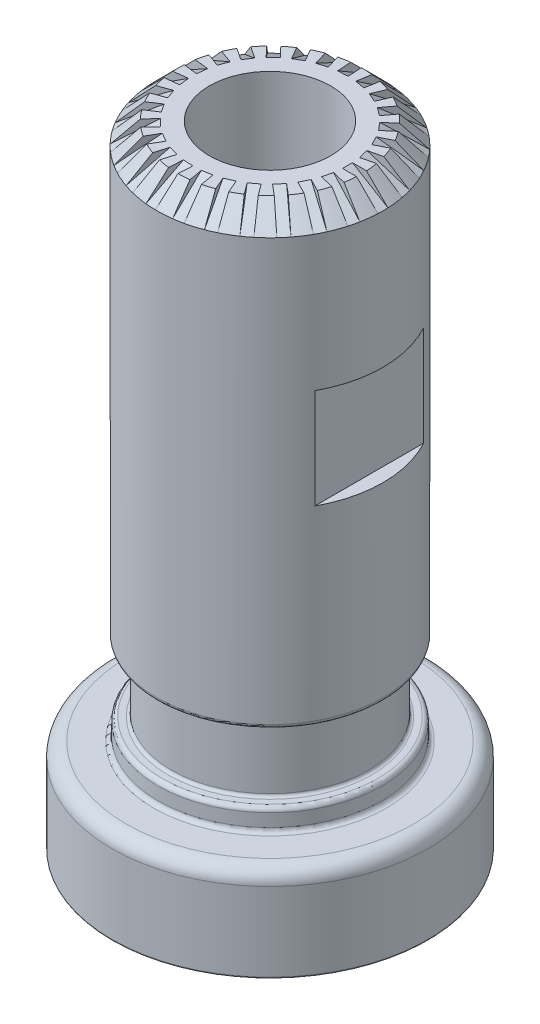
SolidWorks part; units mm, degrees
ref_plane "Plan de face" through (0, 0, 0) normal (0, 0, 1) x (1, 0, 0)
ref_plane "Plan de dessus" through (0, 0, 0) normal (0, 1, 0) x (1, 0, 0)
ref_plane "Plan de droite" through (0, 0, 0) normal (1, 0, 0) x (0, 0, -1)
sketch "Esquisse1" plane through (0, 0, 0) normal (0, 0, 1) x (1, 0, 0)
  line L0 (0, 0) -> (0, 50.3974) construction
  line L1 (2.75, 21.15) -> (2.75, 5.2)
  line L2 (4.2, 5.2) -> (4.2, 3)
  line L3 (8.1, 3) -> (8.1, 0.5)
  line L4 (8.1, 0.5) -> (9, 0.5)
  line L5 (9, 0.5) -> (9.3, 0)
  line L6 (9.3, 0) -> (9.7, 0)
  line L7 (9.7, 0) -> (10, 0.5)
  line L8 (10, 0.5) -> (11.075, 0.5)
  line L9 (11.075, 0.5) -> (11.075, 7.1)
  line L10 (4.2, 3) -> (8.1, 3)
  line L11 (2.75, 5.2) -> (4.2, 5.2)
  line L12 (11.075, 7.1) -> (7.85, 7.1)
  line L13 (7.85, 7.1) -> (7.85, 8.6)
  line L14 (6.925, 8.6) -> (6.925, 13.4)
  line L15 (7.85, 8.6) -> (6.925, 8.6)
  line L16 (6.925, 13.4) -> (7.925, 13.4)
  line L17 (7.925, 13.4) -> (7.925, 43.25)
  line L18 (2.75, 21.15) -> (1.25, 21.15)
  line L19 (1.25, 21.15) -> (1.25, 23.25)
  line L20 (6.425, 44.75) -> (4.25, 44.75)
  line L21 (7.925, 43.25) -> (6.425, 44.75)
  line L22 (2.75, 36.3) -> (4.25, 36.3)
  line L23 (4.25, 36.3) -> (4.25, 44.75)
  line L24 (2.75, 36.3) -> (2.75, 23.25)
  line L25 (2.75, 23.25) -> (1.25, 23.25)
  point P21 (7.925, 44.75)
  dimension "D1" = 5.5
  dimension "D2" = 8.4
  dimension "D3" = 16.2
  dimension "D4" = 22.15
  dimension "D5" = 20
  dimension "D6" = 1
  dimension "D7" = 0.3
  dimension "D8" = 0.4
  dimension "D9" = 3
  dimension "D10" = 5.2
  dimension "D11" = 0.5
  dimension "D12" = 0.5
  dimension "D13" = 7.1
  dimension "D14" = 15.7
  dimension "D15" = 8.6
  dimension "D16" = 13.85
  dimension "D17" = 4.8
  dimension "D18" = 44.75
  dimension "D19" = 15.85
  dimension "D20" = 21.15
  dimension "D21" = 2.5
  dimension "D24" = 1.5
  dimension "D22" = 8.5
  dimension "D23" = 8.45
  dimension "D25" = 5.5
  dimension "D26" = 21.5
revolve "Révolution1" add sketch "Esquisse1" angle 360 about L0
fillet "Congé1" radius 1 1 edges at (0, 7.1, -11.075)
fillet "Congé2" radius 0.2 2 edges at (0, 8.6, -6.925) (0, 13.4, -6.925)
fillet "Congé3" radius 0.3 3 edges at (0, 7.1, -7.85) (0, 8.6, -7.85) (0, 13.4, -7.925)
fillet "Congé4" radius 0.1 8 edges at (0, 3, -4.2) (0, 3, -8.1) (0, 0, -9.3) (0, 0, -9.7) (0, 0.5, -8.1) (0, 0.5, -9) (0, 0.5, -10) (0, 0.5, -11.075)
sketch "Esquisse2" plane through (0, 0, 0) normal (0, 0, 1) x (1, 0, 0)
  line L0 (7.925, 43.25) -> (4.1555, 45.5166)
  line L1 (7.925, 43.25) -> (-7.925, 43.25) construction
  line L2 (4.1555, 45.5166) -> (9.2879, 45.5166)
  line L3 (9.2879, 45.5166) -> (9.9588, 41.8627)
  line L4 (9.9588, 41.8627) -> (7.925, 43.25)
extrude "Enlèv. mat.-Extru.1" cut sketch "Esquisse2" against normal mid plane 0.7
pattern_circular "Répétition circulaire1" count 27 over 360 about axis through (0, 0, 0) along (0, 1, 0) of "Enlèv. mat.-Extru.1"
sketch "Esquisse4" plane through (0, 0, 0) normal (0, 0, 1) x (1, 0, 0)
  line L0 (0, 0) -> (0, 50.3974) construction
  line L1 (-14.842, 33.75) -> (-6.95, 33.75)
  line L2 (-14.842, 33.75) -> (-14.842, 26.75)
  line L3 (-14.842, 26.75) -> (-6.95, 26.75)
  line L4 (-6.95, 33.75) -> (-6.95, 26.75)
  line L5 (11.0026, 33.75) -> (6.95, 33.75)
  line L6 (11.0026, 33.75) -> (11.0026, 26.75)
  line L7 (11.0026, 26.75) -> (6.95, 26.75)
  line L8 (6.95, 33.75) -> (6.95, 26.75)
  dimension "D1" = 13.9
  dimension "D2" = 6.95
  dimension "D3" = 7
  dimension "D4" = 11
  dimension "D5" = 7
  dimension "D6" = 11
extrude "Enlèv. mat.-Extru.2" cut sketch "Esquisse4" against normal mid plane 80.7
